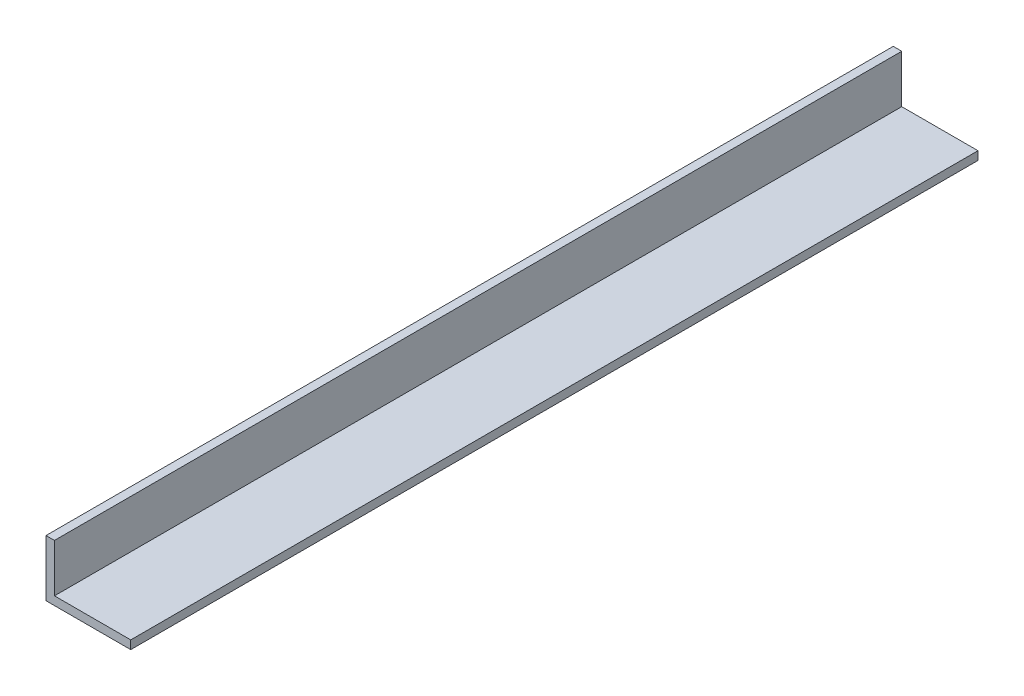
SolidWorks part; units mm, degrees
ref_plane "前视基准面" through (0, 0, 0) normal (0, 0, 1) x (1, 0, 0)
ref_plane "上视基准面" through (0, 0, 0) normal (0, 1, 0) x (1, 0, 0)
ref_plane "右视基准面" through (0, 0, 0) normal (1, 0, 0) x (0, 0, -1)
sketch "草图1" plane through (0, 0, 0) normal (0, 0, 1) x (1, 0, 0)
  line L0 (0, 0) -> (0, 17)
  line L1 (0, 17) -> (-3, 17)
  line L2 (-3, 17) -> (-3, -3)
  line L3 (-3, -3) -> (27, -3)
  line L4 (27, -3) -> (27, 0)
  line L5 (27, 0) -> (0, 0)
  dimension "D1" = 20
  dimension "D2" = 17
  dimension "D3" = 30
  dimension "D4" = 3
extrude "凸台-拉伸1" add sketch "草图1" along normal mid plane 300
